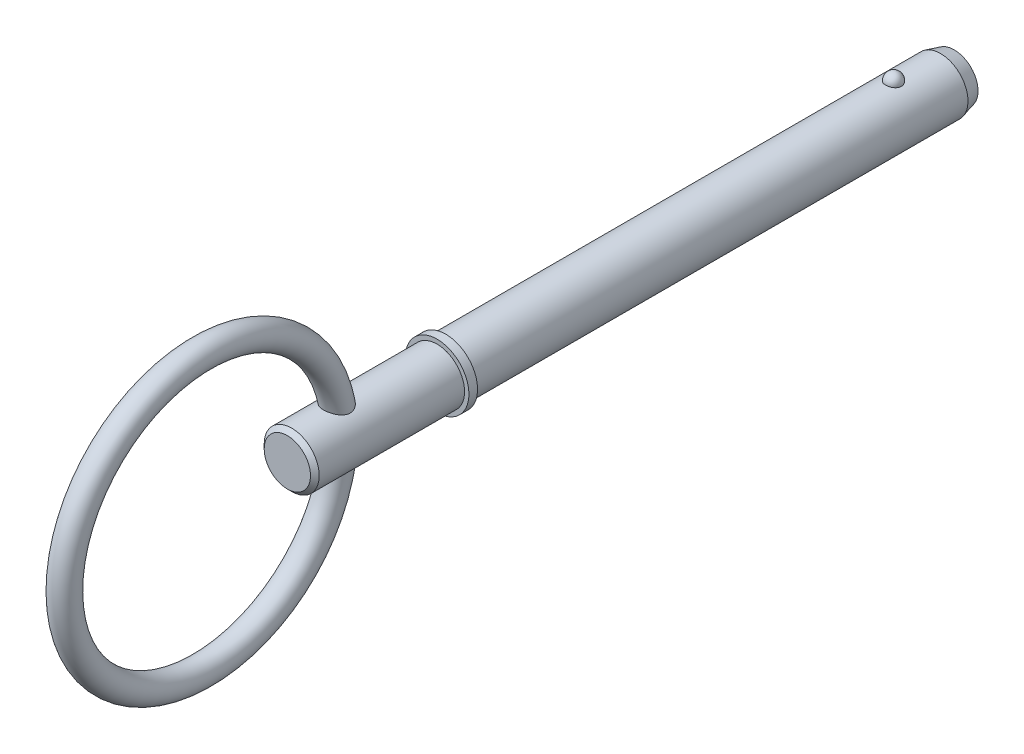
SolidWorks part; units mm, degrees
ref_plane "Front Plane" through (0, 0, 0) normal (0, 0, 1) x (1, 0, 0)
ref_plane "Top Plane" through (0, 0, 0) normal (0, 1, 0) x (1, 0, 0)
ref_plane "Right Plane" through (0, 0, 0) normal (1, 0, 0) x (0, 0, -1)
sketch "Sketch2" plane through (0, 0, 0) normal (0, 0, 1) x (1, 0, 0)
  circle A0 centre (0, 0) radius 3.175
  point P3 (0, 3.175)
  dimension "D1" = 6.35
extrude "Boss-Extrude1" add sketch "Sketch2" along normal blind 50.8
sketch "Sketch3" plane through (0, 0, 0) normal (0, 0, -1) x (-1, 0, 0)
  circle A0 centre (0, 0) radius 3.175
  dimension "D1" = 6.35
extrude "Boss-Extrude2" add sketch "Sketch3" along normal blind 7.92
chamfer "Chamfer1" distance 1.586 angle 15 1 edges at (-3.175, 0, -7.92)
sketch "Sketch18" plane through (0, 0, 0) normal (1, 0, 0) x (0, 0, -1)
  line L0 (6.334, 3.175) -> (-50.8, 3.175) construction
  line L1 (0.91, 4.085) -> (0.91, 2.265)
  line L2 (-50.8, -3.175) -> (6.334, -3.175) construction
  arc A0 (0.91, 4.085) -> (0.91, 2.265) centre (0.91, 3.175) ccw
  point P4 (0, 3.175)
  dimension "D1" = 7.26
revolve "Revolve1" add sketch "Sketch18" angle 360 about L1
sketch "Sketch19" plane through (0, 0, 0) normal (1, 0, 0) x (0, 0, -1)
  line L0 (-33.7288, 0) -> (-46.4542, 0) construction
sketch "Sketch20" plane through (0, 0, 0) normal (1, 0, 0) x (0, 0, -1)
  line L0 (-50.8, 0) -> (-50.8, 3.675)
  line L1 (-50.8, 3.175) -> (-50.8, -3.175) construction
  line L2 (-50.8, 3.675) -> (-51.8, 3.675)
  line L3 (-51.8, 3.675) -> (-51.8, 0)
  line L4 (-33.7288, 0) -> (-46.4542, 0) construction
  line L5 (-51.8, 0) -> (-50.8, 0)
  dimension "D1" = 3.675
  dimension "D2" = 1
revolve "Revolve2" add sketch "Sketch20" angle 360 about L0
sketch "Sketch21" plane through (0, 0, 50.8) normal (0, 0, -1) x (-1, 0, 0)
  circle A0 centre (0, 0) radius 3.175
  dimension "D1" = 6.35
extrude "Boss-Extrude3" add sketch "Sketch21" against normal blind 18.29
chamfer "Chamfer2" distance 0.5 angle 45 1 edges at (-3.175, 0, 69.09)
sketch "Sketch23" plane through (0, 0, 0) normal (1, 0, 0) x (0, 0, -1)
  line L0 (-69.09, 2.675) -> (-69.09, -2.675) construction
  circle A0 centre (-78.965, 0) radius 15.875
  point P2 (-63.09, 0)
  dimension "D1" = 31.75
  dimension "D2" = 6
sketch "Sketch24" plane through (0, 0, 0) normal (0, 1, 0) x (1, 0, 0)
  circle A0 centre (0, -63.09) radius 1.5
  dimension "D1" = 3
sweep "Sweep1" add profiles "Sketch24" path "Sketch23"
